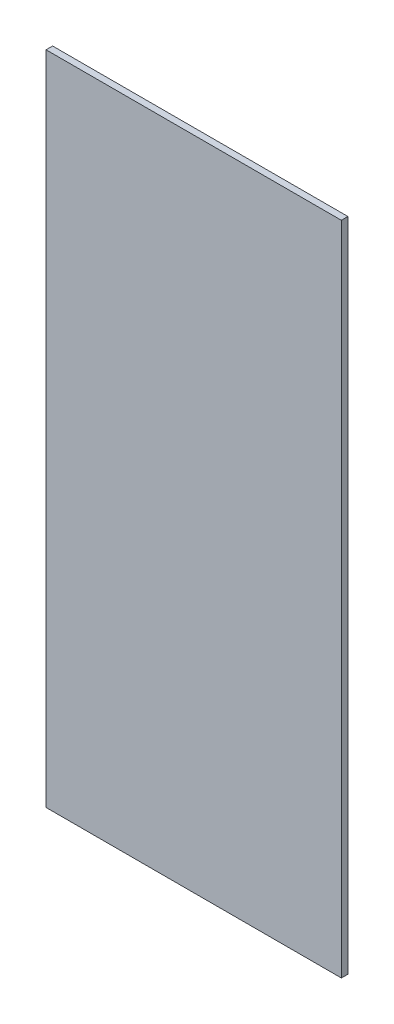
SolidWorks part; units mm, degrees
ref_plane "Vorne" through (0, 0, 0) normal (0, 0, 1) x (1, 0, 0)
ref_plane "Oben" through (0, 0, 0) normal (0, 1, 0) x (1, 0, 0)
ref_plane "Rechts" through (0, 0, 0) normal (1, 0, 0) x (0, 0, -1)
sketch "Skizze1" plane through (0, 0, 0) normal (0, 0, 1) x (1, 0, 0)
  line L1 (0, 0) -> (900, 0)
  line L2 (0, 0) -> (0, 2000)
  line L3 (0, 2000) -> (900, 2000)
  line L4 (900, 0) -> (900, 2000)
  dimension "D1" = 900
  dimension "D2" = 2000
extrude "Linear austragen1" add sketch "Skizze1" against normal blind 20
